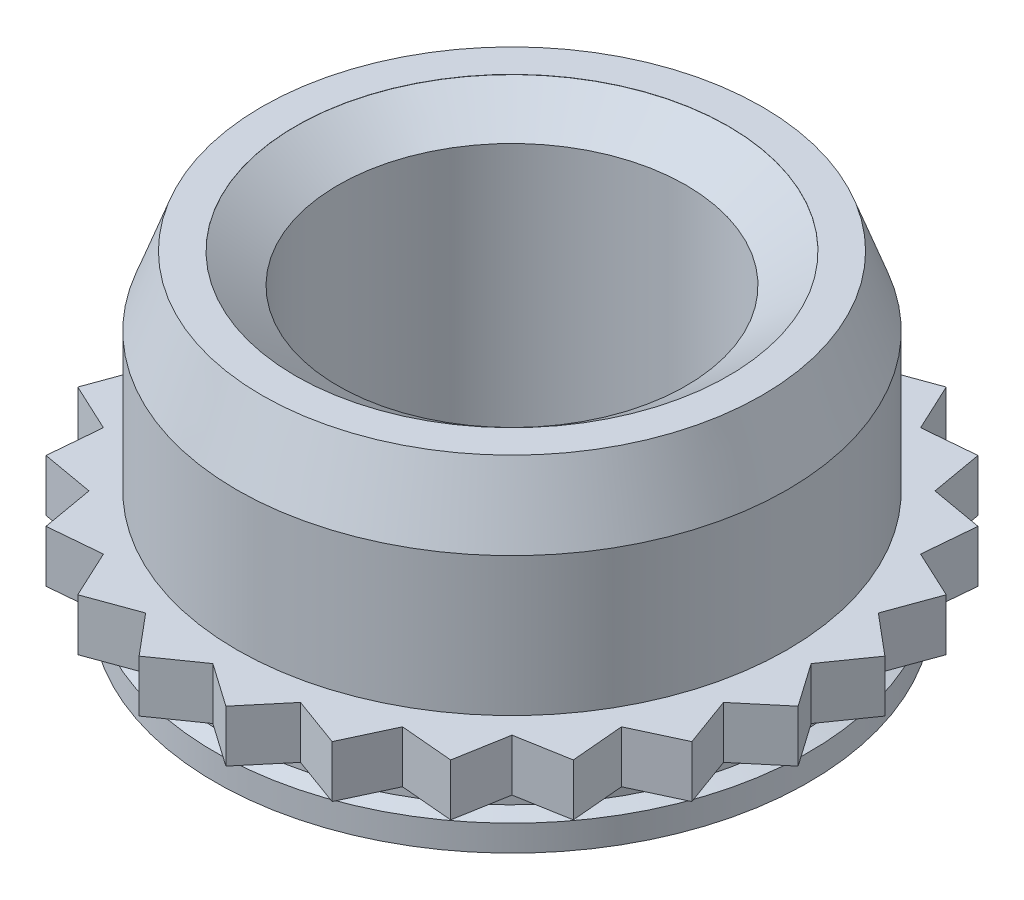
SolidWorks part; units mm, degrees
ref_plane "Plane1" through (0, 0, 0) normal (0, 0, 1) x (1, 0, 0)
ref_plane "Plane2" through (0, 0, 0) normal (0, 1, 0) x (1, 0, 0)
ref_plane "Plane3" through (0, 0, 0) normal (1, 0, 0) x (0, 0, -1)
sketch "BodySke" plane through (0, 0, 0) normal (0, 0, 1) x (1, 0, 0)
  line L0 (4.1383, -1.0637) -> (4.1383, -0.762)
  line L1 (4.0386, 2.032) -> (3.6688, 3.048)
  line L2 (4.8768, 0) -> (4.0386, 0)
  line L3 (2.5527, 3.048) -> (2.5527, -1.524)
  line L4 (2.5527, -1.524) -> (4.3561, -1.524)
  line L5 (4.3561, -1.524) -> (4.3561, -1.143)
  line L6 (4.3561, -1.143) -> (4.1383, -1.0637)
  line L7 (1.016, 1.27) -> (4.0386, 1.27) construction
  line L8 (4.0386, 0) -> (4.0386, 2.032)
  line L9 (0, 0) -> (0, 15.24) construction
  line L11 (3.6688, 3.048) -> (2.5527, 3.048)
  line L15 (4.1383, -0.762) -> (4.8768, -0.762)
  line L16 (4.8768, -0.762) -> (4.8768, 0)
  dimension "D1" = 20
  dimension "D2" = 70
  dimension "C_dia" = 8.7122
  dimension "A_ht" = 1.524
  dimension "Thread_min" = 5.1054
  dimension "Clinch_dia" = 9.7536
  dimension "C_len" = 0.381
  dimension "Clinching_ht" = 0.762
  dimension "Advance" = 1.27
  dimension "D_dia" = 8.0772
  dimension "Height" = 3.048
  dimension "Groove_dia" = 8.2766
  dimension "Chamfer_ht" = 1.016
revolve "Body" add sketch "BodySke"
revolve "EndChamfer" cut sketch "EndChamferSke" angle 360 about L0
sketch "EndChamferSke" plane through (0, 0, 0) normal (0, 0, 1) x (1, 0, 0)
  line L0 (0, -2.54) -> (0, 7.62) construction
  line L1 (0, 0) -> (0, 15.24) construction
  line L2 (3.175, -1.778) -> (3.175, -1.5215)
  line L3 (3.175, -1.5215) -> (2.5527, -1.0859)
  line L4 (2.5527, -1.0859) -> (2.5527, -1.778)
  line L5 (2.5527, -1.778) -> (3.175, -1.778)
  line L6 (3.175, 3.0455) -> (3.175, 3.302)
  line L7 (3.175, 3.302) -> (2.5527, 3.302)
  line L8 (2.5527, 3.302) -> (2.5527, 2.6099)
  line L9 (2.5527, 2.6099) -> (3.175, 3.0455)
  line L10 (3.6688, 3.048) -> (-3.6688, 3.048) construction
  line L11 (-4.3561, -1.524) -> (4.3561, -1.524) construction
  line L12 (2.5527, 3.048) -> (-2.5527, 3.048) construction
  dimension "D1" = 0.254
  dimension "Thread_nominal" = 6.35
  dimension "D2" = 34.99
  dimension "D3" = 0.254
  dimension "Thread_min" = 5.1054
  dimension "Inset" = 0.0025
  dimension "Inset_far" = 0.0025
ref_plane "Plane4" through (0, -0.5486, 0) normal (0, 1, 0) x (-1, 0, 0)
sketch "ThdSchSke" plane through (0, 0, 0) normal (0, 0, 1) x (1, 0, 0)
  line L0 (0, -5.08) -> (0, 7.62) construction
  line L1 (0, 0) -> (0, 15.24) construction
  line L2 (0, -1.5215) -> (3.175, -1.5215) construction
  line L4 (3.175, -1.5215) -> (2.5527, -1.0857)
  line L6 (3.175, -1.5215) -> (2.5527, -1.9572)
  line L7 (2.5527, -1.0857) -> (2.5527, -1.9572)
  line L8 (3.175, -1.5215) -> (-3.175, -1.5215) construction
  dimension "Vee_angle" = 70
  dimension "Thread_nominal" = 6.35
  dimension "Thread_min" = 5.1054
revolve "ThreadSchematic" [suppressed] cut sketch "ThdSchSke" angle 360 about L0
pattern_linear "ThdSchPat" [suppressed]
sketch "CliRinCutSke" plane through (0, -0.762, 0) normal (0, -1, 0) x (1, 0, 0)
  line L0 (0.6366, 4.8351) -> (0, 4.3891)
  line L1 (0, 4.3891) -> (-0.6366, 4.8351)
  line L2 (0, 0) -> (0, 5.842) construction
  arc A1 (0.6366, 4.8351) -> (-0.6366, 4.8351) centre (0, 0) ccw
  circle A2 centre (0, 0) radius 4.3891 construction
  dimension "Clinch_dia" = 9.7536
  dimension "Clinch_minor" = 8.7782
  dimension "Angle" = 15
extrude "ClinchCut" cut sketch "CliRinCutSke" against normal blind 0.762
pattern_circular "ClinchCutPat" count 24 every 15 about axis through (0, 0, 0) along (0, 1, 0) of "ClinchCut"
equation "' \"A_ht@BodySke\" = 0.06"
equation "' \"D_dia@BodySke\" = 0.318"
equation "' \"C_dia@BodySke\" = 0.343"
equation "' \"Height@BodySke\" = 0.12"
equation "' \"Clinch_dia@BodySke\" = 0.384"
equation "' \"Advance@BodySke\" = 0.05"
equation "' \"Thread_min@BodySke\" = 0.201"
equation "' \"Thread_nominal@ThreadCosmetic\" = 0.25"
equation "\"Count@ClinchCutPat\" = 24"
equation "\"Angle@ClinchCutPat\" = 360 / \"Count@ClinchCutPat\""
equation "\"Angle@CliRinCutSke\" = 360 / \"Count@ClinchCutPat\""
equation "\"Clinch_dia@CliRinCutSke\" = \"Clinch_dia@BodySke\""
equation "\"Clinch_minor@CliRinCutSke\" = \"Clinch_dia@BodySke\" * 0.9"
equation "\"C_len@BodySke\" = \"A_ht@BodySke\" * 0.25"
equation "\"Groove_dia@BodySke\" = \"C_dia@BodySke\" * 0.95"
equation "\"Clinching_ht@BodySke\" = \"A_ht@BodySke\" * 0.5"
equation "\"Depth@ClinchCut\" =  \"A_ht@BodySke\" * 0.5"
equation "\"Chamfer_ht@BodySke\" = \"Height@BodySke\" / 3"
equation "\"Thread_nominal@EndChamferSke\" = \"Thread_nominal@ThreadCosmetic\""
equation "\"Thread_min@EndChamferSke\" = \"Thread_min@BodySke\""
equation "\"D2@EndChamferSke\" = \"Vee_angle@ThdSchSke\" / 2 - 0.01"
equation "\"Thread_nominal@ThdSchSke\" = \"Thread_nominal@ThreadCosmetic\""
equation "\"Thread_min@ThdSchSke\" = \"Thread_min@BodySke\""
equation "\"Num_threads@ThdSchPat\" = int(  ( \"Height@BodySke\" + \"A_ht@BodySke\" - \"Inset@EndChamferSke\" - \"Inset_far@EndChamferSke\" ) / \"Advance@BodySke\" + 0.999 )  + 1"
equation "\"Advance@ThdSchPat\" = ( \"Height@BodySke\" + \"A_ht@BodySke\" - \"Inset@EndChamferSke\" - \"Inset_far@EndChamferSke\" ) /  (\"Num_threads@ThdSchPat\" - 1) 'relax it"
